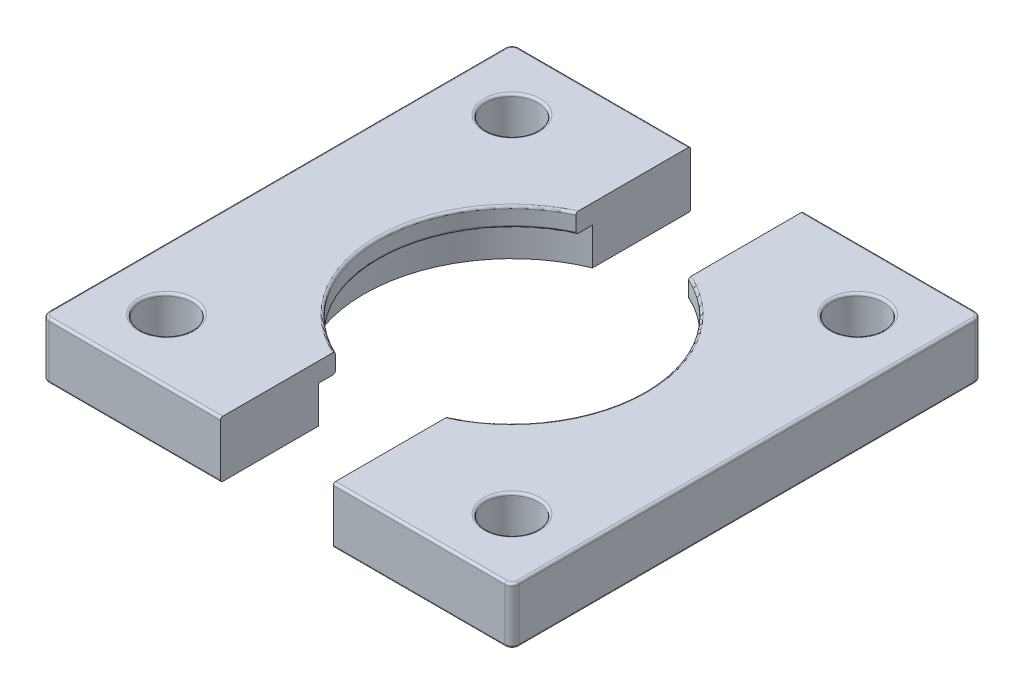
SolidWorks part; units mm, degrees
ref_plane "Front Plane" through (0, 0, 0) normal (0, 0, 1) x (1, 0, 0)
ref_plane "Top Plane" through (0, 0, 0) normal (0, 1, 0) x (1, 0, 0)
ref_plane "Right Plane" through (0, 0, 0) normal (1, 0, 0) x (0, 0, -1)
sketch "Sketch1" plane through (0, 0, 0) normal (0, 1, 0) x (1, 0, 0)
  line L0 (-28.25, 0) -> (28.25, 0) construction
  line L1 (0, 28.25) -> (0, -28.25) construction
  line L2 (12, 50) -> (12, 25.5746)
  line L3 (-48.5, 50) -> (-12, 50)
  line L4 (-50, 48.5) -> (-50, -48.5)
  line L5 (-48.5, -50) -> (-12, -50)
  line L6 (50, 48.5) -> (50, -48.5)
  line L7 (-12, 50) -> (-12, 25.5746)
  line L8 (12, 50) -> (48.5, 50)
  line L9 (-12, -25.5746) -> (-12, -50)
  line L10 (12, -25.5746) -> (12, -50)
  line L11 (12, -50) -> (48.5, -50)
  arc A0 (-12, 25.5746) -> (-12, -25.5746) centre (0, 0) ccw
  circle A1 centre (-36.75, 36.75) radius 5.5
  circle A2 centre (36.75, 36.75) radius 5.5
  circle A3 centre (36.75, -36.75) radius 5.5
  circle A4 centre (-36.75, -36.75) radius 5.5
  arc A5 (-50, -48.5) -> (-48.5, -50) centre (-48.5, -48.5) ccw
  arc A6 (48.5, -50) -> (50, -48.5) centre (48.5, -48.5) ccw
  arc A7 (48.5, 50) -> (50, 48.5) centre (48.5, 48.5) cw
  arc A8 (-48.5, 50) -> (-50, 48.5) centre (-48.5, 48.5) ccw
  arc A9 (12, -25.5746) -> (12, 25.5746) centre (0, 0) ccw
  point P21 (-50, -50)
  point P24 (50, -50)
  point P29 (-50, 50)
  dimension "D1" = 56.5
  dimension "D6" = 11
  dimension "D9" = 1.5
  dimension "D2" = 100
  dimension "D3" = 100
  dimension "D4" = 50
  dimension "D5" = 50
  dimension "D7" = 73.5
  dimension "D8" = 73.5
  dimension "D10" = 24
  dimension "D11" = 12
extrude "Boss-Extrude1" add sketch "Sketch1" along normal blind 12
sketch "Sketch2" plane through (0, 0, 0) normal (0, -1, 0) x (1, 0, 0)
  circle A0 centre (0, 0) radius 31.5
  dimension "D1" = 63
extrude "Cut-Extrude1" cut sketch "Sketch2" against normal blind 7.9
fillet "Fillet1" radius 0.5 14 edges at (30.25, 0, 50) (49.5607, 0, 49.5607) (50, 0, 0) (49.5607, 0, -49.5607) (30.25, 12, 50) (49.5607, 12, 49.5607) (50, 12, 0) (49.5607, 12, -49.5607) (30.25, 0, -50) (28.25, 7.9, 0) (28.25, 12, 0) (30.25, 12, -50) (36.75, 12, -42.25) (36.75, 12, 42.25)
fillet "Fillet2" radius 0.5 14 edges at (-30.25, 12, 50) (-49.5607, 12, 49.5607) (-50, 12, 0) (-49.5607, 12, -49.5607) (-30.25, 0, 50) (-49.5607, 0, 49.5607) (-50, 0, 0) (-49.5607, 0, -49.5607) (-28.25, 12, 0) (-28.25, 7.9, 0) (-36.75, 12, -31.25) (-30.25, 12, -50) (-30.25, 0, -50) (-36.75, 12, 31.25)
